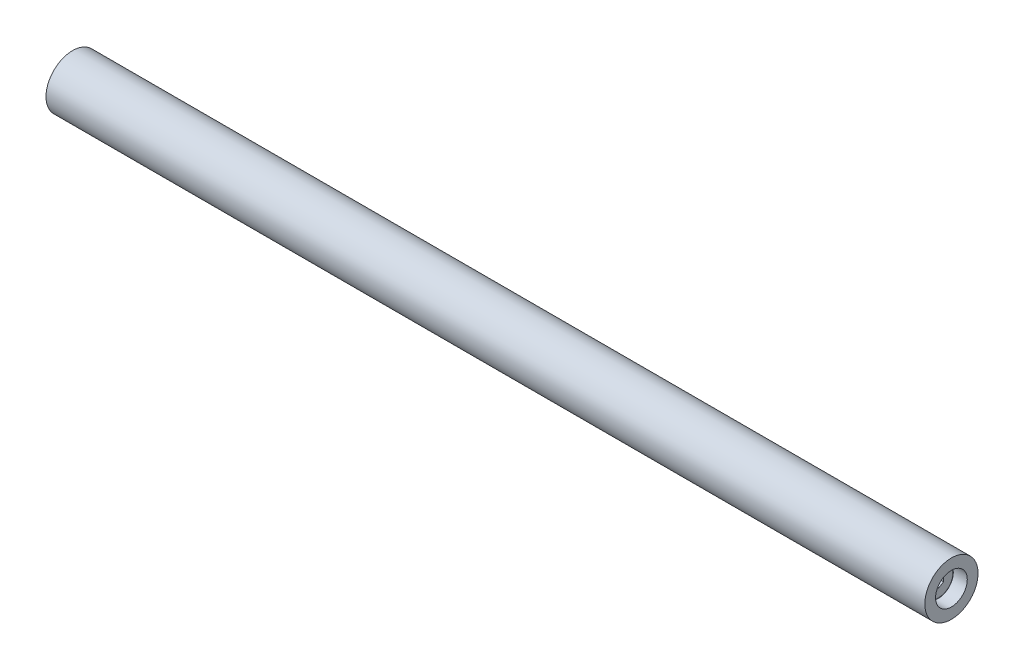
SolidWorks part; units mm, degrees
ref_plane "Front Plane" through (0, 0, 0) normal (0, 0, 1) x (1, 0, 0)
ref_plane "Top Plane" through (0, 0, 0) normal (0, 1, 0) x (1, 0, 0)
ref_plane "Right Plane" through (0, 0, 0) normal (1, 0, 0) x (0, 0, -1)
sketch "Sketch1" plane through (0, 0, 0) normal (0, 0, 1) x (1, 0, 0)
  line L0 (0, 0) -> (0, 10.0076)
  line L1 (0, 10.0076) -> (330.2, 10.0076)
  line L2 (330.2, 10.0076) -> (330.2, 0)
  line L3 (330.2, 0) -> (0, 0)
  line L4 (330.2, 0) -> (0, 0) construction
revolve "Revolve1" add sketch "Sketch1" angle 360 about L4
ref_plane "Plane1" through (304.8, 0, 0) normal (1, 0, 0) x (0, 0, -1)
sketch "Sketch2" plane through (0, 0, 0) normal (1, 0, 0) x (0, 0, -1)
  circle A0 centre (0, 0) radius 5.9563
ref_plane "Plane2" through (330.2, 0, 0) normal (1, 0, 0) x (0, 0, -1)
sketch "Sketch3" plane through (330.2, 0, 0) normal (1, 0, 0) x (0, 0, -1)
  circle A0 centre (0, 0) radius 5.9563
extrude "Cut-Extrude1" cut sketch "Sketch3" against normal blind 9.525
extrude "Cut-Extrude2" cut sketch "Sketch2" along normal blind 9.525
sketch "Sketch4" plane through (0, 0, 0) normal (0, 0, 1) x (1, 0, 0)
  line L0 (4.7625, 0) -> (4.7625, 5.2578)
  line L1 (5.2705, 5.7658) -> (9.525, 5.7658)
  line L2 (9.525, 5.7658) -> (9.525, 0)
  line L3 (9.525, 0) -> (4.7625, 0)
  line L4 (9.525, 0) -> (4.7625, 0) construction
  arc A0 (4.7625, 5.2578) -> (5.2705, 5.7658) centre (5.2705, 5.2578) cw
revolve "Revolve2" add sketch "Sketch4" angle 360 about L4
sketch "Sketch5" plane through (0, 0, 0) normal (0, 0, 1) x (1, 0, 0)
  line L0 (320.675, 0) -> (320.675, 5.7658)
  line L1 (320.675, 5.7658) -> (324.9295, 5.7658)
  line L2 (325.4375, 5.2578) -> (325.4375, 0)
  line L3 (325.4375, 0) -> (320.675, 0)
  line L4 (325.4375, 0) -> (320.675, 0) construction
  arc A0 (324.9295, 5.7658) -> (325.4375, 5.2578) centre (324.9295, 5.2578) cw
revolve "Revolve3" add sketch "Sketch5" angle 360 about L4
ref_plane "Plane3" through (4.7625, 0, 0) normal (1, 0, 0) x (0, 0, -1)
sketch "Sketch6" plane through (4.7625, 0, 0) normal (1, 0, 0) x (0, 0, -1)
  line L0 (-1.8352, 1.0595) -> (-1.8352, -1.0595)
  line L1 (-1.8352, -1.0595) -> (0, -2.119)
  line L2 (0, -2.119) -> (1.8352, -1.0595)
  line L3 (1.8352, -1.0595) -> (1.8352, 1.0595)
  line L4 (1.8352, 1.0595) -> (0, 2.119)
  line L5 (0, 2.119) -> (-1.8352, 1.0595)
ref_plane "Plane4" through (325.4375, 0, 0) normal (1, 0, 0) x (0, 0, -1)
sketch "Sketch7" plane through (325.4375, 0, 0) normal (1, 0, 0) x (0, 0, -1)
  line L0 (-1.8352, 1.0595) -> (-1.8352, -1.0595)
  line L1 (-1.8352, -1.0595) -> (0, -2.119)
  line L2 (0, -2.119) -> (1.8352, -1.0595)
  line L3 (1.8352, -1.0595) -> (1.8352, 1.0595)
  line L4 (1.8352, 1.0595) -> (0, 2.119)
  line L5 (0, 2.119) -> (-1.8352, 1.0595)
extrude "Cut-Extrude3" cut sketch "Sketch7" against normal blind 2.3813
extrude "Cut-Extrude4" cut sketch "Sketch6" along normal blind 2.3813
